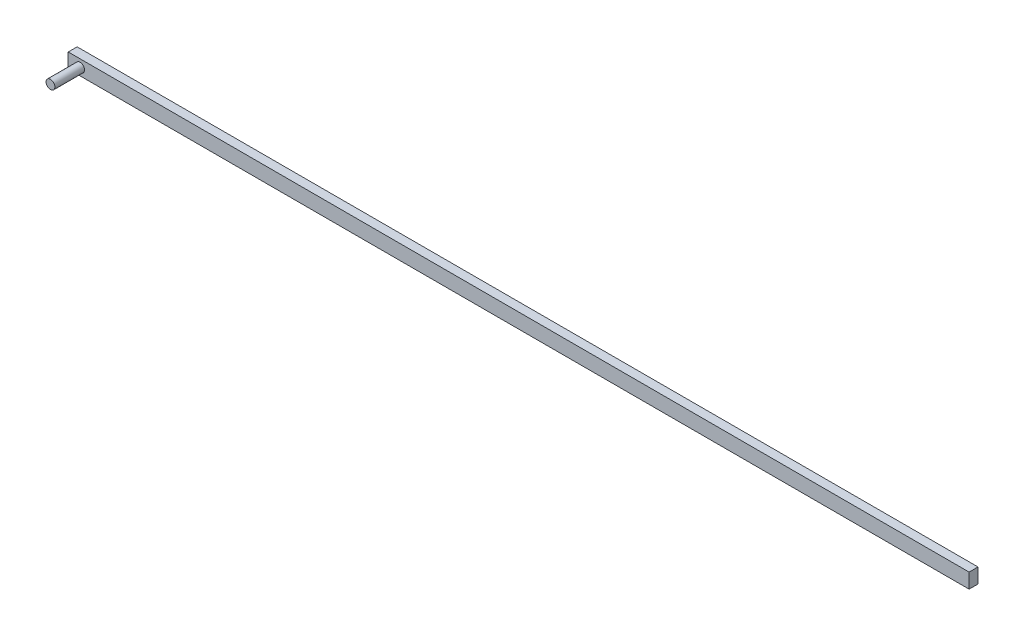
SolidWorks part; units mm, degrees
ref_plane "Plan de face" through (0, 0, 0) normal (0, 0, 1) x (1, 0, 0)
ref_plane "Plan de dessus" through (0, 0, 0) normal (0, 1, 0) x (1, 0, 0)
ref_plane "Plan de droite" through (0, 0, 0) normal (1, 0, 0) x (0, 0, -1)
sketch "Esquisse1" plane through (0, 0, 0) normal (0, 0, 1) x (1, 0, 0)
  line L1 (0, 0) -> (3040, 0)
  line L2 (0, 0) -> (0, 50)
  line L3 (0, 50) -> (3040, 50)
  line L4 (3040, 0) -> (3040, 50)
  dimension "D1" = 3040
  dimension "D2" = 50
extrude "Boss.-Extru.1" add sketch "Esquisse1" along normal blind 30
sketch "Esquisse5" plane through (0, 0, 30) normal (0, 0, 1) x (1, 0, 0)
  line L0 (3040, 50) -> (0, 50) construction
  line L1 (0, 50) -> (0, 0) construction
  circle A0 centre (40, 25) radius 15
  dimension "D1" = 30
  dimension "D2" = 25
  dimension "D3" = 40
extrude "Boss.-Extru.2" add sketch "Esquisse5" along normal blind 100
